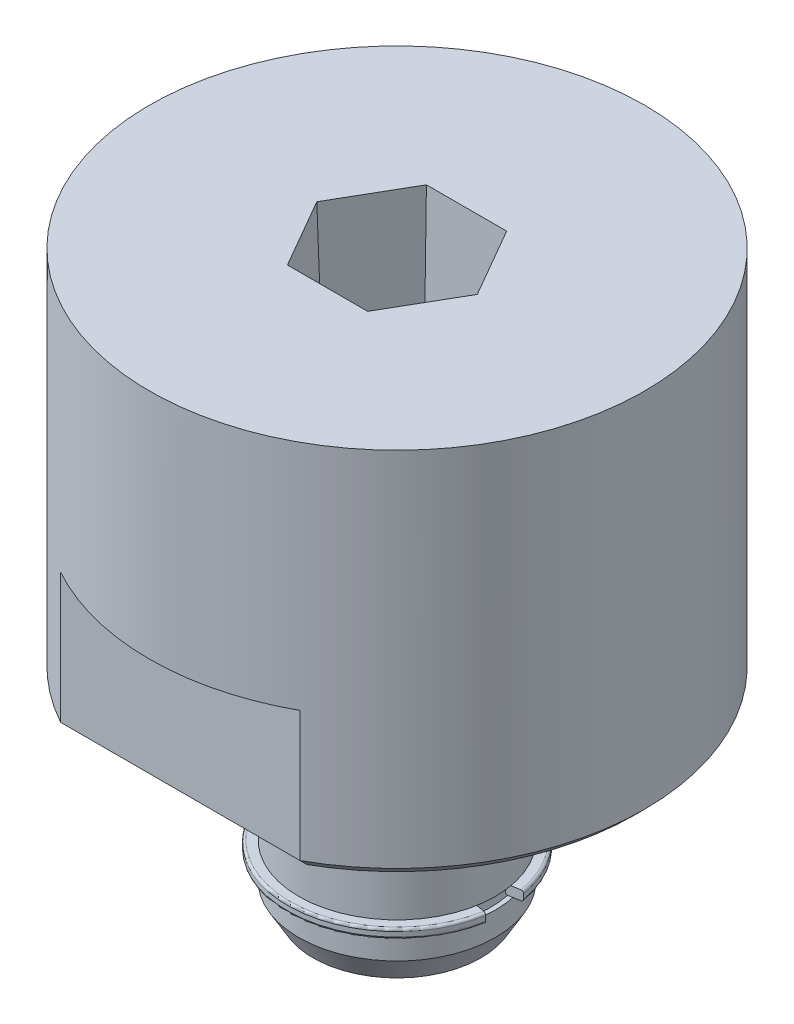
SolidWorks part; units mm, degrees
ref_plane "Front Plane" through (0, 0, 0) normal (0, 0, 1) x (1, 0, 0)
ref_plane "Top Plane" through (0, 0, 0) normal (0, 1, 0) x (1, 0, 0)
ref_plane "Right Plane" through (0, 0, 0) normal (1, 0, 0) x (0, 0, -1)
sketch "Sketch1" plane through (0, 0, 0) normal (0, 0, 1) x (1, 0, 0)
  line L0 (0, 0) -> (0, 17.4951) construction
  line L1 (0, 0) -> (2.7131, 0)
  line L2 (2.7131, 0) -> (3.175, 0.8)
  line L3 (3.175, 0.8) -> (3.175, 1.57)
  line L4 (3.175, 1.57) -> (3.025, 1.57)
  line L5 (3.025, 1.57) -> (3.025, 1.95)
  line L6 (3.025, 1.95) -> (3.175, 1.95)
  line L7 (3.175, 1.95) -> (3.175, 6)
  line L8 (3.675, 6.5) -> (7.9975, 6.5)
  line L9 (7.9975, 6.5) -> (7.9975, 18.5)
  line L10 (7.9975, 18.5) -> (0, 18.5)
  line L11 (0, 18.5) -> (0, 0)
  arc A0 (3.175, 6) -> (3.675, 6.5) centre (3.675, 6) cw
  dimension "D10" = 0.5
  dimension "D1" = 15.995
  dimension "D2" = 12
  dimension "D3" = 6.5
  dimension "D4" = 6.35
  dimension "D5" = 30
  dimension "D6" = 0.8
  dimension "D7" = 6.05
  dimension "D8" = 0.38
  dimension "D9" = 4.55
revolve "Revolve1" add sketch "Sketch1" angle 360 about L0
sketch "Sketch2" plane through (0, 6.5, 0) normal (0, -1, 0) x (1, 0, 0)
  line L0 (-7.9975, 0) -> (7.9975, 0) construction
  line L1 (-3.8678, -7) -> (3.8678, -7)
  line L2 (-3.8678, 7) -> (3.8678, 7)
  arc A0 (-3.8678, -7) -> (3.8678, -7) centre (0, 0) ccw
  circle A1 centre (0, 0) radius 7.9975 construction
  arc A2 (3.8678, 7) -> (-3.8678, 7) centre (0, 0) ccw
  dimension "D1" = 14
extrude "Cut-Extrude1" cut sketch "Sketch2" against normal blind 4.5
sketch "Sketch3" plane through (0, 18.5, 0) normal (0, 1, 0) x (1, 0, 0)
  line L1 (-1.1547, 2) -> (-2.3094, 0)
  line L2 (-2.3094, 0) -> (-1.1547, -2)
  line L3 (-1.1547, -2) -> (1.1547, -2)
  line L4 (1.1547, -2) -> (2.3094, 0)
  line L5 (2.3094, 0) -> (1.1547, 2)
  line L6 (1.1547, 2) -> (-1.1547, 2)
  line L7 (-8.7973, 0) -> (8.7973, 0) construction
  circle A0 centre (0, 0) radius 2 construction
  dimension "D1" = 4
extrude "Cut-Extrude2" cut sketch "Sketch3" against normal blind 7
sketch "Sketch4" plane through (0, 0, 0) normal (0, 0, 1) x (1, 0, 0)
  line L0 (5.75, 6.0694) -> (5.75, 7.1421) construction
  line L2 (5.75, 6.5) -> (6.309, 6.5)
  line L4 (3.8678, 6.5) -> (7.9975, 6.5) construction
  line L5 (5.75, 6.75) -> (5.75, 6.5)
  arc A0 (6.309, 6.5) -> (5.75, 6.75) centre (5.75, 6) ccw
  dimension "D2" = 0.75
  dimension "D3" = 0.25
  dimension "D1" = 5.75
revolve "Cut-Revolve1" cut sketch "Sketch4" angle 360 about L0
pattern_circular "CirPattern1" count 8 over 360 about axis through (0, 0, 0) along (0, 1, 0) of "Cut-Revolve1"
chamfer "Chamfer1" distance 0.3 angle 45 4 edges at (0, 6.5, -7) (7.9975, 6.5, 0) (-7.9975, 6.5, 0) (0, 6.5, 7)
draft "Draft2" type of draft neutral plane draft angle 2 faces to draft 6 parameters "D1"=2
imported_body "VS-25.sldprt"
move or copy body "Body-Move/Copy2" bodies to move or copy 110 placed by mates yes parameters "D1"=0, "D2"=0, "D3"=0
